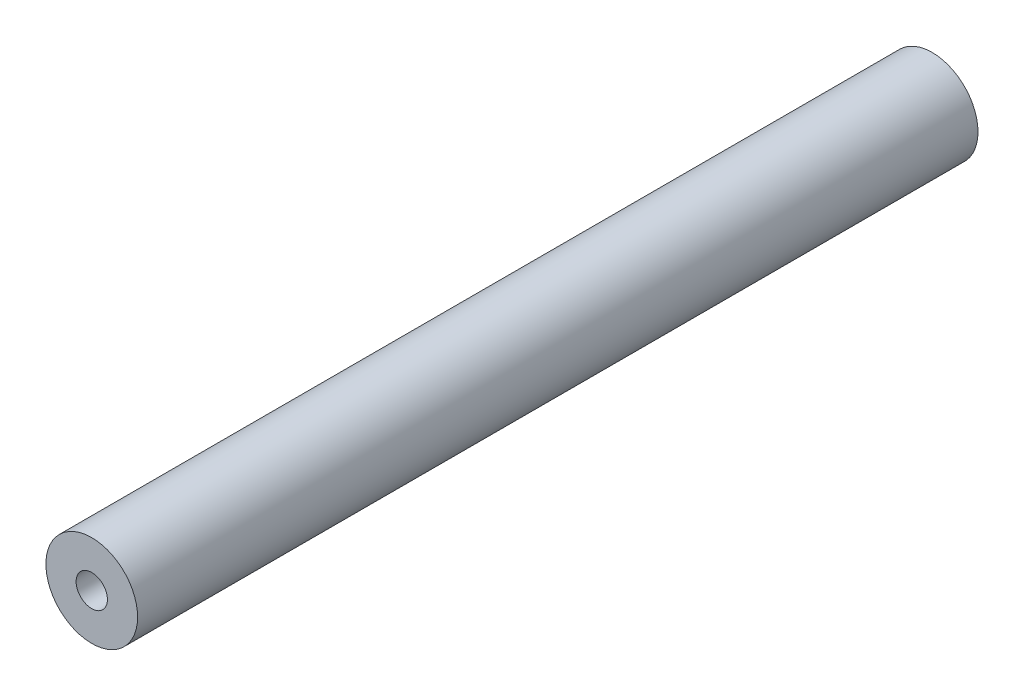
SolidWorks part; units mm, degrees
ref_plane "Plano frontal" through (0, 0, 0) normal (0, 0, 1) x (1, 0, 0)
ref_plane "Plano superior" through (0, 0, 0) normal (0, 1, 0) x (1, 0, 0)
ref_plane "Plano direito" through (0, 0, 0) normal (1, 0, 0) x (0, 0, -1)
sketch "Esboço1" plane through (0, 0, 0) normal (0, 0, 1) x (1, 0, 0)
  circle A0 centre (0, 0) radius 3
  dimension "D1" = 6
extrude "Ressalto-extrusão1" add sketch "Esboço1" along normal blind 55
hole_wizard "Broca de rosquear para tarraxa de M2.51" positions "3DSketch3" profile "Esboço3" hole size "M2.5" standard "ISO"
sketch3d "3DSketch3"
  point P0 (0, 0, 55)
  point P6 (-1.382, 0.6846, 55)
sketch "Esboço3" plane through (0, 0, 55) normal (1, 0, 0) x (0, -1, 0)
  line L0 (0, 0) -> (0, 4.6159)
  line L1 (0, 4.6159) -> (1.025, 4)
  line L2 (1.025, 4) -> (1.025, 0)
  line L5 (1.025, 0) -> (0, 0)
  line L10 (0, 4.6159) -> (-1.025, 4) construction
  line L11 (0, -6.35) -> (0, 107.95) construction
  dimension "Hole Dia." = 2.05
  dimension "Hole Depth" = 4
  dimension "Drill Angle" = 118
hole_wizard "Broca de rosquear para tarraxa de M2.52" positions "Esboço4" profile "Esboço5" hole size "M2.5" standard "ISO"
sketch "Esboço4" plane through (0, 0, 0) normal (0, 0, -1) x (-1, 0, 0)
  point P0 (0, 0)
  point P4 (0, 0)
sketch "Esboço5" plane through (0, 0, 0) normal (1, 0, 0) x (0, 1, 0)
  line L0 (0, 0) -> (0, 4.6159)
  line L1 (0, 4.6159) -> (1.025, 4)
  line L2 (1.025, 4) -> (1.025, 0)
  line L5 (1.025, 0) -> (0, 0)
  line L10 (0, 4.6159) -> (-1.025, 4) construction
  line L11 (0, -6.35) -> (0, 107.95) construction
  dimension "Hole Dia." = 2.05
  dimension "Hole Depth" = 4
  dimension "Drill Angle" = 118
